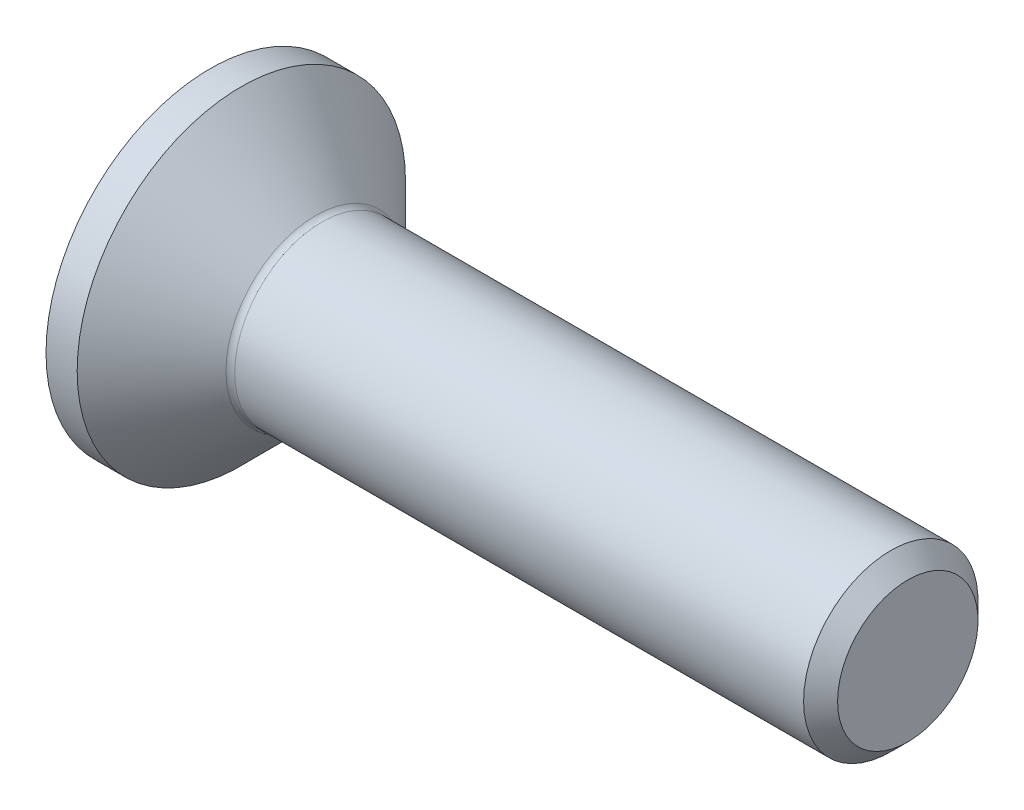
SolidWorks part; units mm, degrees
revolve "PreBroach" cut sketch "Sketch2"
sketch "Sketch2"
  line L0 (0, 1.25) -> (1.5, 1.25)
  line L1 (1.5, 1.25) -> (2.2217, 0)
  line L2 (0, 0) -> (127, 0) construction
  line L3 (2.2217, 0) -> (0, 0)
  line L4 (0, 0) -> (0, 1.25)
  line L5 (0, -1.25) -> (1.5, -1.25) construction
  line L6 (0, 0) -> (47.625, 0) construction
  line L8 (0, 3.765) -> (0, -3.765) construction
revolve "BaseBody" add sketch "BodySke"
sketch "BodySke" plane through (0, 0, 0) normal (0, 0, 1) x (1, 0, 0)
  line L0 (0, 0) -> (0, 3.765)
  line L1 (0.715, 3.765) -> (2.48, 2)
  line L2 (0, 3.765) -> (0.715, 3.765)
  line L3 (2.48, 2) -> (15.61, 2)
  line L4 (16, 1.61) -> (16, 0)
  line L5 (16, 0) -> (0, 0)
  line L6 (0, 0) -> (127, 0) construction
  line L7 (0.715, -3.765) -> (2.48, -2) construction
  line L8 (16, 1.61) -> (15.61, 2)
  line L9 (0, -3.765) -> (0.715, -3.765) construction
  line L10 (16, -1.61) -> (15.61, -2) construction
  line L11 (3.18, 8.35) -> (3.18, -13.875) construction
  line L12 (0, 19.05) -> (0, -3.175) construction
fillet "Fillet1" radius 0.2 1 edges at (2.48, 0, 2)
ref_plane "Plane1" through (0, 0, 0) normal (0, 0, 1) x (1, 0, 0)
ref_plane "Plane2" through (0, 0, 0) normal (0, 1, 0) x (1, 0, 0)
ref_plane "Plane3" through (0, 0, 0) normal (1, 0, 0) x (0, 0, -1)
sketch "Sketch3" plane through (0, 0, 0) normal (-1, 0, 0) x (0, 0, 1)
  line L0 (-1.25, -0.7217) -> (-1.25, 0.7217)
  line L1 (-1.25, 0.7217) -> (0, 1.4434)
  line L2 (0, 1.4434) -> (1.25, 0.7217)
  line L3 (1.25, 0.7217) -> (1.25, -0.7217)
  line L4 (1.25, -0.7217) -> (0, -1.4434)
  line L5 (0, -1.4434) -> (-1.25, -0.7217)
extrude "Hex" cut sketch "Sketch3" against normal blind 1.5
sketch "ThdSchSke" plane through (0, 0, 0) normal (0, 0, 1) x (1, 0, 0)
  line L0 (4.58, -1.61) -> (4.3069, -2)
  line L1 (4.58, -1.61) -> (4.8531, -2)
  line L2 (4.8531, -2) -> (4.8531, -2.5)
  line L3 (-3.175, 0) -> (5.1513, 0) construction
  line L4 (0, 3.765) -> (0, -3.765) construction
  line L5 (4.8531, -2.5) -> (4.3069, -2.5)
  line L6 (4.3069, -2.5) -> (4.3069, -2)
revolve "ThreadSchematic" [suppressed] cut sketch "ThdSchSke" angle 360 about L3
pattern_linear "ThdSchPat" [suppressed]
equation "\"Thread_minor@ThreadCosmetic\"  =  \"Minor_dia@BodySke\""
equation "\"D1@Sketch3\" = \"Hex_size@Sketch3\" / 2"
equation "\"D2@Sketch3\" = \"D1@Sketch3\""
equation "\"D3@Sketch3\" = \"Hex_size@Sketch3\""
equation "\"Thread_length@ThreadCosmetic\" = ((sgn( (\"Length@BodySke\" - \"Advance@BodySke\" * 3.0 - \"Head_ht@BodySke\" ) - \"Thread_nom@BodySke\" )-1)*( (\"Length@BodySke\" - \"Advance@BodySke\" * 3.0 - \"Head_ht@BodySke\" "
equation "\"Thread_minor@ThdSchSke\" = \"Minor_dia@BodySke\""
equation "\"Diameter@ThdSchSke\" = \"Diameter@BodySke\""
equation "\"Overcut@ThdSchSke\" = \"Diameter@BodySke\" * 1.25"
equation "\"Start@ThdSchSke\" = 0.000001 + \"Length@BodySke\" - \"Thread_length@ThreadCosmetic\"  '---Countersunk---"
equation "\"Num_threads@ThdSchPat\" = int( \"Thread_length@ThreadCosmetic\" / \"Advance@BodySke\" + 0.999 )  + 1"
equation "\"Advance@ThdSchPat\" = \"Thread_length@ThreadCosmetic\" /  (\"Num_threads@ThdSchPat\" - 1) 'relax it"
equation "\"Num_threads@ThdSchPat\" = \"Num_threads@ThdSchPat\" - sgn( \"Num_threads@ThdSchPat\" - 1) '---chamfered tips only---"
